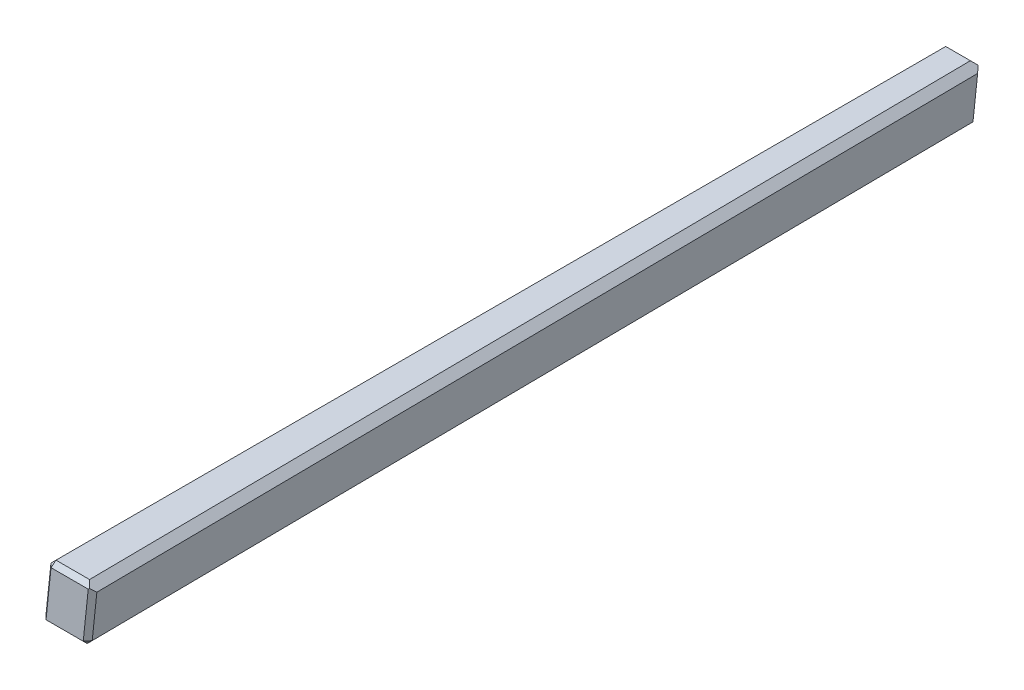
SolidWorks part; units mm, degrees
ref_plane "Plan de face" through (0, 0, 0) normal (0, 0, 1) x (1, 0, 0)
ref_plane "Plan de dessus" through (0, 0, 0) normal (0, 1, 0) x (1, 0, 0)
ref_plane "Plan de droite" through (0, 0, 0) normal (1, 0, 0) x (0, 0, -1)
sketch "Esquisse1" plane through (0, 0, 0) normal (0, 0, 1) x (1, 0, 0)
  line L0 (0, 0) -> (3.3108, 31.5)
  line L1 (3.3108, 31.5) -> (24.3108, 31.5)
  line L2 (24.3108, 31.5) -> (21, 0)
  line L3 (21, 0) -> (0, 0)
  line L4 (0, 0) -> (0, 53.7923) construction
  line L5 (24.3108, 31.5) -> (24.3108, -23.3865) construction
  dimension "D1" = 6
  dimension "D2" = 6
  dimension "D3" = 31.5
  dimension "D4" = 21
ref_plane "Plan1" through (0, 0, 470) normal (0, 0, 1) x (1, 0, 0)
sketch "Esquisse2" plane through (0, 0, 470) normal (0, 0, 1) x (1, 0, 0)
  line L0 (24.3108, 31.5) -> (21, 0) construction
  line L4 (3.3108, 31.5) -> (0, 0)
  line L5 (24.3108, 31.5) -> (3.3108, 31.5)
  line L6 (21, 0) -> (24.3108, 31.5)
  line L7 (0, 0) -> (21, 0)
  line L8 (3.3108, 31.5) -> (0, 0)
  line L9 (29.0108, 31.5) -> (3.3108, 31.5)
  line L10 (25.7, 0) -> (29.0108, 31.5)
  line L11 (0, 0) -> (25.7, 0)
  dimension "D2" = 4.7
  dimension "D1" = 0
ref_plane "Plan2" through (0, 0, -30) normal (0, 0, 1) x (1, 0, 0)
sketch "Esquisse3" plane through (0, 0, -30) normal (0, 0, 1) x (1, 0, 0)
  line L1 (24.3108, 31.5) -> (21, 0) construction
  line L4 (3.3108, 31.5) -> (0, 0)
  line L5 (24.3108, 31.5) -> (3.3108, 31.5)
  line L6 (21, 0) -> (24.3108, 31.5)
  line L7 (0, 0) -> (21, 0)
  line L8 (3.3108, 31.5) -> (0, 0)
  line L9 (24.0108, 31.5) -> (3.3108, 31.5)
  line L10 (20.7, 0) -> (24.0108, 31.5)
  line L11 (0, 0) -> (20.7, 0)
  dimension "D2" = 5
  dimension "D1" = 0
loft "Lissage2" add profiles "Esquisse2", "Esquisse3"
chamfer "Chanfrein1" distance 2.5 angle 45 12 edges
chamfer "Chanfrein2" distance 4.5 angle 45 1 edges
equation "\"D2@Esquisse2\" = \"D1@Plan1\" * 0.01"
equation "\"D2@Esquisse3\" = \"D1@Plan2\" * 0.01"
